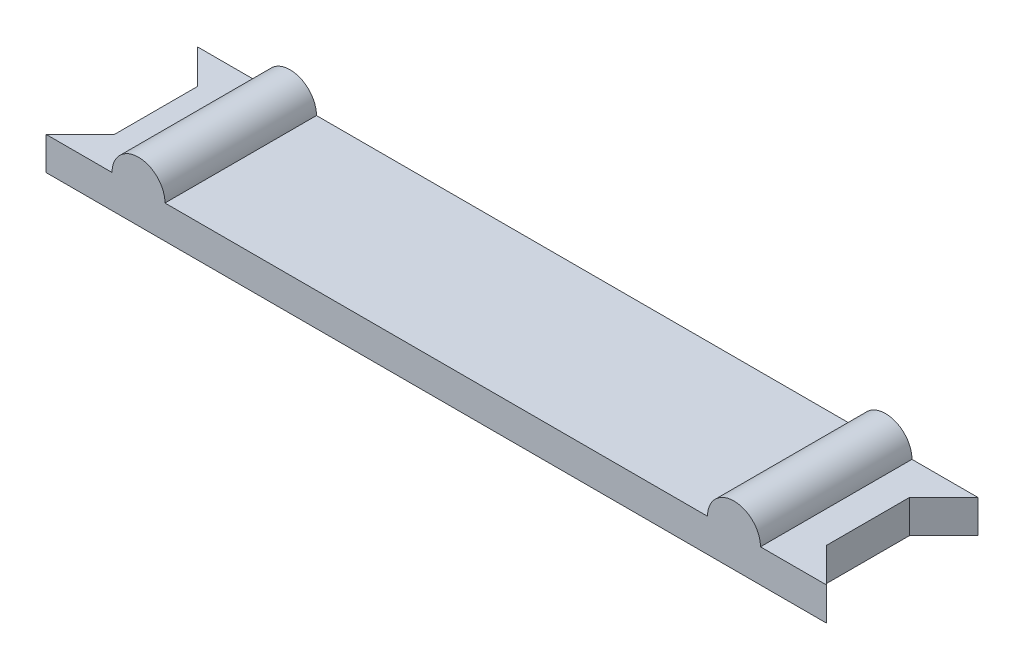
SolidWorks part; units mm, degrees
ref_plane "Ebene vorne" through (0, 0, 0) normal (0, 0, 1) x (1, 0, 0)
ref_plane "Ebene oben" through (0, 0, 0) normal (0, 1, 0) x (1, 0, 0)
ref_plane "Ebene rechts" through (0, 0, 0) normal (1, 0, 0) x (0, 0, -1)
sketch "Sketch1" plane through (0, 0, 0) normal (0, 1, 0) x (1, 0, 0)
  line L0 (-29.491, 5.725) -> (-26.9, 3.14)
  line L1 (-29.491, -5.725) -> (29.491, -5.725)
  line L2 (-29.491, -5.725) -> (-29.491, 5.725)
  line L3 (-29.491, 5.725) -> (29.491, 5.725)
  line L4 (29.491, -5.725) -> (29.491, 5.725)
  line L5 (-29.491, -5.725) -> (29.491, 5.725) construction
  line L6 (-29.491, 5.725) -> (29.491, -5.725) construction
  line L7 (-26.9, 3.14) -> (-26.9, -3.14)
  line L8 (-26.9, -3.14) -> (-29.491, -5.725)
  line L9 (29.491, 5.725) -> (26.9, 3.14)
  line L10 (26.9, 3.14) -> (26.9, -3.14)
  line L11 (26.9, -3.14) -> (29.491, -5.725)
  point P0 (0, 0)
  point P10 (-40.7122, -3.1919)
  point P11 (26.9, 0)
  point P12 (-26.9, 0)
  dimension "D1" = 3.66
  dimension "D2" = 6.28
  dimension "D3" = 11.45
  dimension "D4" = 53.8
extrude "Boss-Extrude1" add sketch "Sketch1" along normal blind 2.5 contours L11 L10 L9 L3 L0 L7 L8 L1
sketch "Sketch2" plane through (0, 0, 5.725) normal (0, 0, 1) x (1, 0, 0)
  line L0 (0, 0) -> (0, 11.3022) construction
  line L1 (-29.491, 2.5) -> (29.491, 2.5) construction
  circle A0 centre (22.5, 2.5) radius 2
  circle A1 centre (-22.5, 2.5) radius 2
  point P9 (0, 0)
  point P10 (0, 0)
  dimension "D1" = 4
  dimension "D3" = 45
extrude "Boss-Extrude2" add sketch "Sketch2" against normal up to surface (11.45 mm away) contours A1 M4 | A0 M4
sketch "Sketch3" plane through (0, 0, 0) normal (0, -1, 0) x (1, 0, 0)
  line L0 (-26.9, 0) -> (26.9, 0) construction
  line L1 (-26.9, -3.14) -> (-26.9, 3.14) construction
  line L2 (26.9, -3.14) -> (26.9, 3.14) construction
  line L4 (-7.5, -3.2) -> (7.5, -3.2)
  line L5 (-7.5, -3.2) -> (-7.5, 0)
  line L6 (-7.5, 0) -> (7.5, 0)
  line L7 (7.5, -3.2) -> (7.5, 0)
  line L8 (-7.5, -3.2) -> (7.5, 0) construction
  line L9 (-7.5, 0) -> (7.5, -3.2) construction
  point P6 (0, -1.6)
  point P11 (0, 0)
  dimension "D1" = 3.2
  dimension "D2" = 15
extrude "Cut-Extrude1" cut sketch "Sketch3" against normal offset from surface (1.5 mm away) 1
chamfer "Chamfer1" distance 2 angle 45 2 edges at (7.5, 0, -1.6) (-7.5, 0, -1.6)
